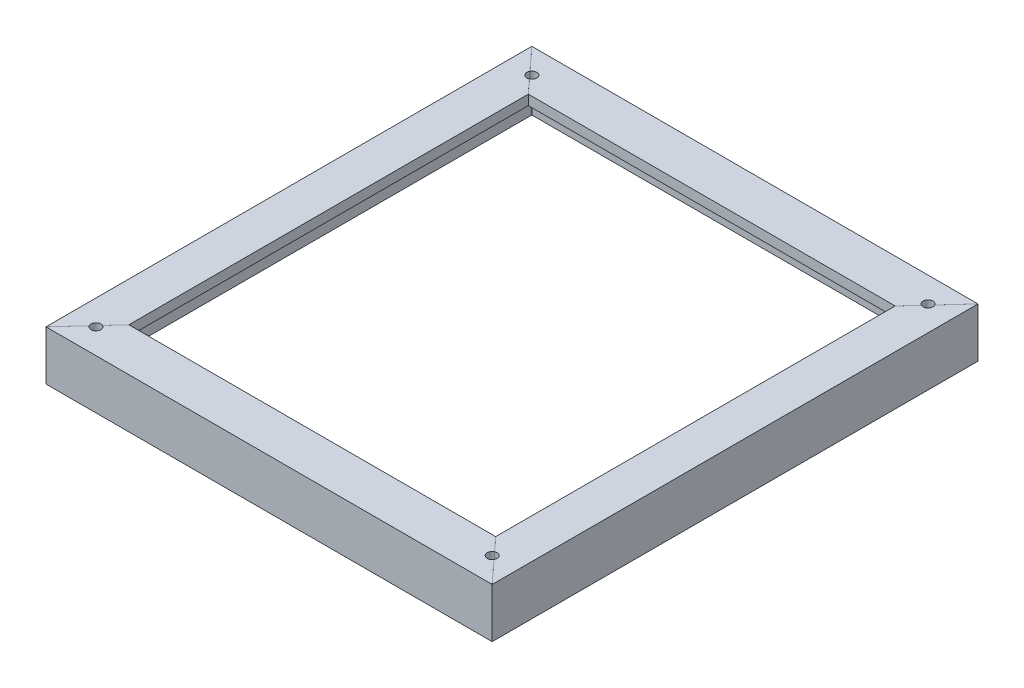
SolidWorks part; units mm, degrees
ref_plane "Front Plane" through (0, 0, 0) normal (0, 0, 1) x (1, 0, 0)
ref_plane "Top Plane" through (0, 0, 0) normal (0, 1, 0) x (1, 0, 0)
ref_plane "Right Plane" through (0, 0, 0) normal (1, 0, 0) x (0, 0, -1)
sketch "Sketch1" plane through (0, 0, 0) normal (0, 1, 0) x (1, 0, 0)
  line L1 (71.4375, -77.7875) -> (-71.4375, -77.7875)
  line L2 (71.4375, -77.7875) -> (71.4375, 77.7875)
  line L3 (71.4375, 77.7875) -> (-71.4375, 77.7875)
  line L4 (-71.4375, -77.7875) -> (-71.4375, 77.7875)
  line L5 (71.4375, -77.7875) -> (-71.4375, 77.7875) construction
  line L6 (71.4375, 77.7875) -> (-71.4375, -77.7875) construction
  line L7 (58.7375, -63.9586) -> (-58.7375, -63.9586)
  line L8 (58.7375, -63.9586) -> (58.7375, 63.9586)
  line L9 (58.7375, 63.9586) -> (-58.7375, 63.9586)
  line L10 (-58.7375, -63.9586) -> (-58.7375, 63.9586)
  line L11 (58.7375, -63.9586) -> (-58.7375, 63.9586) construction
  line L12 (58.7375, 63.9586) -> (-58.7375, -63.9586) construction
  point P0 (0, 0)
  point P6 (0, 0)
  dimension "D1" = 155.575
  dimension "D2" = 142.875
  dimension "D3" = 12.7
extrude "Boss-Extrude1" add sketch "Sketch1" against normal blind 3.175
sketch "Sketch2" plane through (0, -3.175, 0) normal (0, -1, 0) x (1, 0, 0)
  line L1 (68.2625, -74.6125) -> (-68.2625, -74.6125)
  line L2 (68.2625, -74.6125) -> (68.2625, 74.6125)
  line L3 (68.2625, 74.6125) -> (-68.2625, 74.6125)
  line L4 (-71.4375, 77.7875) -> (-71.4375, -77.7875)
  line L5 (-71.4375, -77.7875) -> (71.4375, -77.7875)
  line L6 (71.4375, -77.7875) -> (71.4375, 77.7875)
  line L7 (71.4375, 77.7875) -> (-71.4375, 77.7875)
  line L8 (-71.4375, 77.7875) -> (-71.4375, -77.7875)
  line L9 (-71.4375, -77.7875) -> (71.4375, -77.7875)
  line L10 (71.4375, -77.7875) -> (71.4375, 77.7875)
  line L11 (71.4375, 77.7875) -> (-71.4375, 77.7875)
  line L12 (-68.2625, -74.6125) -> (-68.2625, 74.6125)
  line L13 (68.2625, -74.6125) -> (-68.2625, 74.6125) construction
  line L14 (68.2625, 74.6125) -> (-68.2625, -74.6125) construction
  point P2 (0, 0)
  dimension "D2" = 3.175
  dimension "D3" = 3.175
  dimension "D1" = 0
extrude "Boss-Extrude2" add sketch "Sketch2" along normal blind 12.7
sketch "Sketch7" plane through (0, -3.175, 0) normal (0, -1, 0) x (1, 0, 0)
  line L0 (0, 63.9586) -> (0, -63.9586) construction
  line L1 (-58.7375, 63.9586) -> (58.7375, 63.9586) construction
  line L2 (58.7375, -63.9586) -> (-58.7375, -63.9586) construction
  circle A0 centre (-63.4365, 69.7865) radius 1.59 construction
  circle A1 centre (-63.4365, 69.7865) radius 1.59
  circle A2 centre (-63.4365, -69.7865) radius 1.59 construction
  circle A3 centre (-63.4365, -69.7865) radius 1.59
  circle A4 centre (63.4365, -69.7865) radius 1.59
  circle A5 centre (63.4365, 69.7865) radius 1.59
extrude "Cut-Extrude5" cut sketch "Sketch7" against normal through all
sketch "Sketch10" plane through (0, 0, 0) normal (0, 1, 0) x (1, 0, 0)
  line L0 (-71.4375, 77.7875) -> (71.4375, -77.7875) construction
  line L1 (-71.4394, 77.7858) -> (-0.0034, 0)
  line L2 (-71.4356, 77.7892) -> (0, 0.0038)
  line L3 (-71.4356, 77.7892) -> (-71.4394, 77.7858)
  line L4 (71.4356, -77.7892) -> (71.4394, -77.7858)
  line L5 (0, 0) -> (0, 77.7875) construction
  line L6 (71.4375, 77.7875) -> (-71.4375, 77.7875) construction
  line L7 (71.4375, 77.7875) -> (-71.4375, -77.7875) construction
  line L8 (-71.4356, -77.7892) -> (-71.4394, -77.7858)
  line L9 (71.4356, 77.7892) -> (71.4394, 77.7858)
  line L10 (71.4356, 77.7892) -> (0, 0.0038)
  line L11 (71.4394, 77.7858) -> (0.0034, 0)
  line L12 (-0.0034, 0) -> (-71.4394, -77.7858)
  line L13 (0.0034, 0) -> (71.4394, -77.7858)
  line L14 (0, -0.0038) -> (-71.4356, -77.7892)
  line L15 (-71.4356, 77.7892) -> (71.4394, -77.7858) construction
  line L16 (0, -0.0038) -> (71.4356, -77.7892)
  line L18 (-71.4394, 77.7858) -> (71.4356, -77.7892) construction
  dimension "D1" = 0.0025
  dimension "D2" = 0.0025
extrude "Cut-Extrude8" cut sketch "Sketch10" against normal blind 2540
